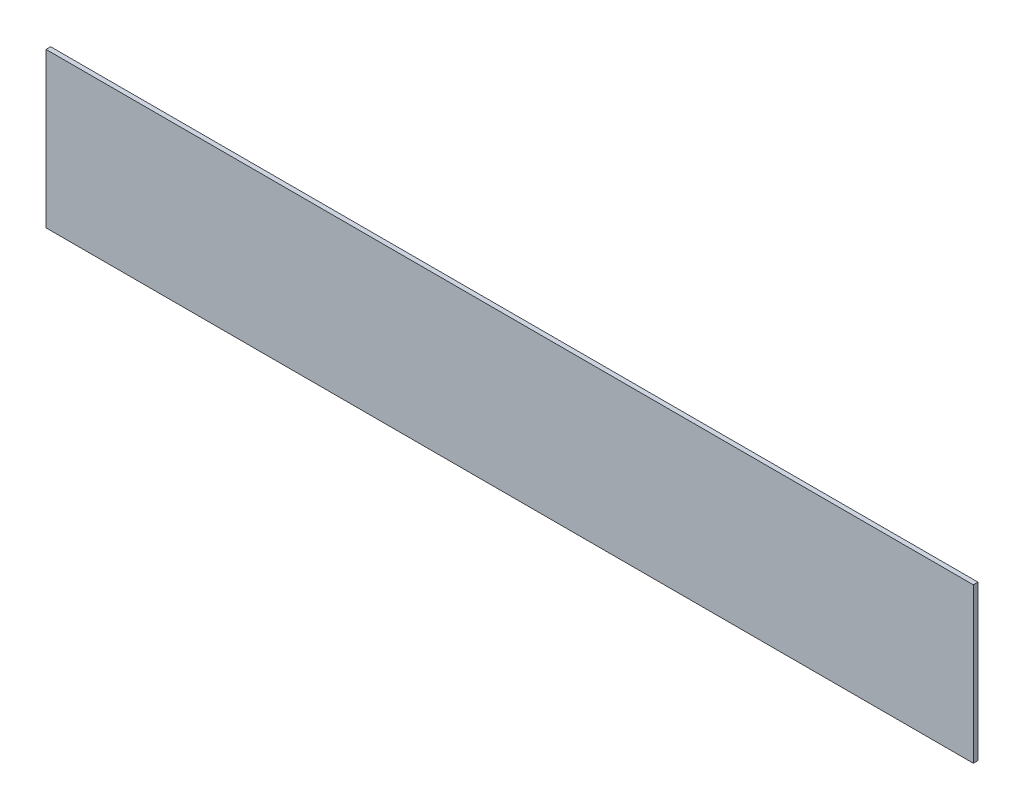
SolidWorks part; units mm, degrees
ref_plane "Front Plane" through (0, 0, 0) normal (0, 0, 1) x (1, 0, 0)
ref_plane "Top Plane" through (0, 0, 0) normal (0, 1, 0) x (1, 0, 0)
ref_plane "Right Plane" through (0, 0, 0) normal (1, 0, 0) x (0, 0, -1)
sketch "Sketch1" plane through (0, 0, 0) normal (0, 0, 1) x (1, 0, 0)
  line L0 (0, 5) -> (0, -5) construction
  line L1 (-30, 5) -> (30, 5)
  line L2 (-30, 5) -> (-30, -5)
  line L3 (-30, -5) -> (30, -5)
  line L4 (30, 5) -> (30, -5)
  line L5 (30, 0) -> (-30, 0) construction
  dimension "D1" = 10
  dimension "D2" = 60
extrude "Extrude2" add sketch "Sketch1" along normal blind 0.3
